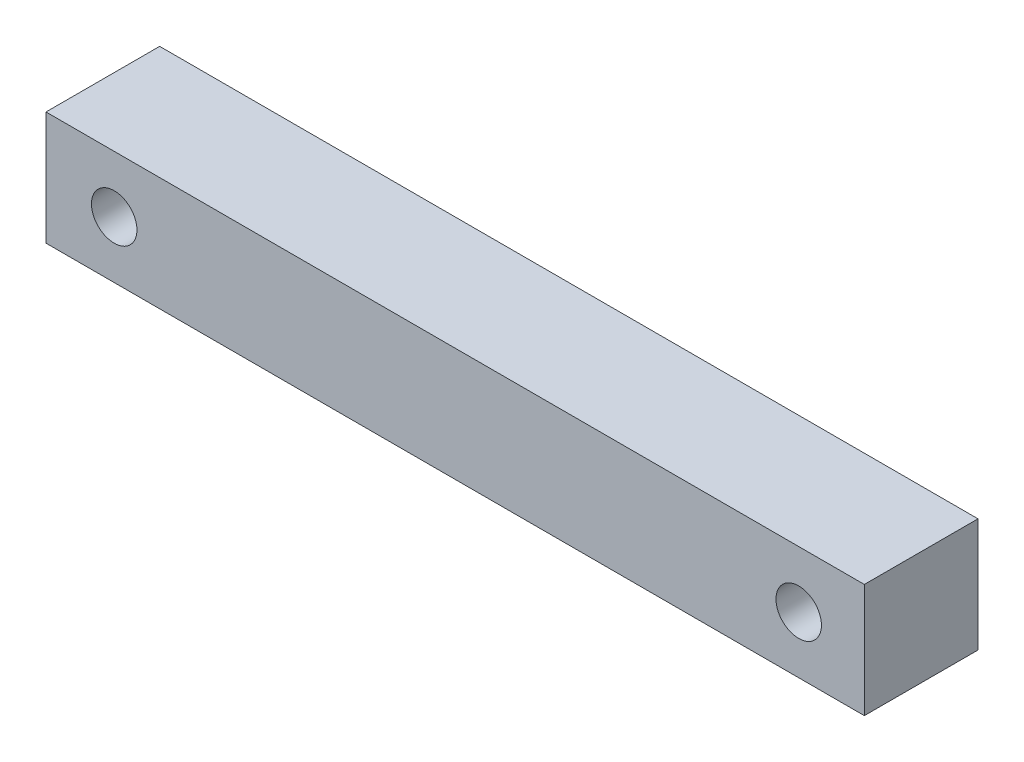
SolidWorks part; units mm, degrees
ref_plane "Front Plane" through (0, 0, 0) normal (0, 0, 1) x (1, 0, 0)
ref_plane "Top Plane" through (0, 0, 0) normal (0, 1, 0) x (1, 0, 0)
ref_plane "Right Plane" through (0, 0, 0) normal (1, 0, 0) x (0, 0, -1)
sketch "Sketch1" plane through (0, 0, 0) normal (0, 0, 1) x (1, 0, 0)
  line L1 (-18, 2.5) -> (18, 2.5)
  line L2 (-18, 2.5) -> (-18, -2.5)
  line L3 (-18, -2.5) -> (18, -2.5)
  line L4 (18, 2.5) -> (18, -2.5)
extrude "Boss-Extrude1" add sketch "Sketch1" along normal blind 5
sketch "Sketch2" plane through (0, 0, 5) normal (0, 0, 1) x (1, 0, 0)
  line L0 (-18, 2.5) -> (-18, -2.5) construction
  circle A0 centre (-15, 0) radius 1
  circle A1 centre (15.112, 0) radius 1
  dimension "D1" = 3
  dimension "D2" = 30.112
extrude "Cut-Extrude1" cut sketch "Sketch2" against normal blind 5
